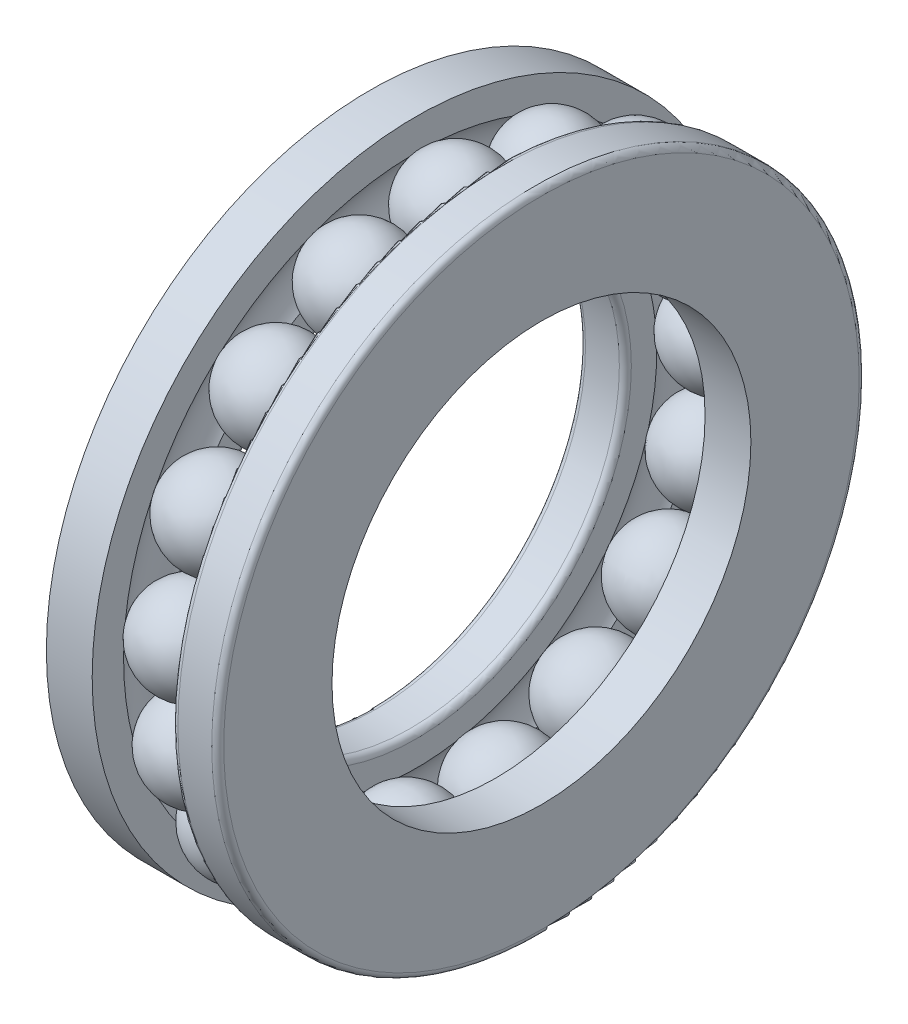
SolidWorks part; units mm, degrees
ref_plane "Plane1" through (0, 0, 0) normal (0, 0, 1) x (1, 0, 0)
ref_plane "Plane2" through (0, 0, 0) normal (0, 1, 0) x (1, 0, 0)
ref_plane "Plane3" through (0, 0, 0) normal (1, 0, 0) x (0, 0, -1)
other "Configuration Table"
sketch "Clipboard" plane through (0, 0, 0) normal (0, 0, 1) x (1, 0, 0)
  line L0 (-10, 0) -> (10, 0) construction
  line L1 (0, 0) -> (21.3836, -6.5376)
  line L2 (0, 0) -> (27.3662, 35.0271)
  line L3 (0, 0) -> (13.7666, -17.6205)
  line L4 (0, 0) -> (-22.3471, -0.7804)
sketch "InnRacSke" plane through (0, 0, 0) normal (0, 0, 1) x (1, 0, 0)
  line L0 (-6.6469, 40.1573) -> (-6.6469, 34.925)
  line L1 (-6.6469, 34.925) -> (-14.2875, 34.925)
  line L2 (-14.2875, 34.925) -> (-14.2875, 53.975)
  line L3 (-14.2875, 53.975) -> (-6.6469, 53.975)
  line L4 (-6.6469, 53.975) -> (-6.6469, 48.7427)
  line L5 (-34.925, 0) -> (34.925, 0) construction
  line L6 (0, 0) -> (0, 25.4) construction
  arc A2 (-6.6469, 48.7427) -> (-6.6469, 40.1573) centre (0, 44.45) ccw
revolve "Race" add sketch "InnRacSke" angle 360 about L5
ref_axis "Axis1" through (-50, 0, 0) along (1, 0, 0)
sketch "BalDetSke" plane through (0, 0, 0) normal (0, 0, 1) x (1, 0, 0)
  line L0 (-7.9375, 44.45) -> (7.9375, 44.45)
  line L1 (-14.5732, 44.45) -> (14.5732, 44.45) construction
  arc A0 (7.9375, 44.45) -> (-7.9375, 44.45) centre (0, 44.45) cw
revolve "BallDetailed" add sketch "BalDetSke" angle 360 about L1
sketch "BalSimSke" plane through (0, 0, 0) normal (0, 0, 1) x (1, 0, 0)
  line L0 (-25.4, 0) -> (25.4, 0) construction
  circle A0 centre (0, 44.45) radius 7.9375
revolve "BallsSimplified" [suppressed] add sketch "BalSimSke" angle 360 about L0
mirror "Mirror1" about plane through (0, 0, 0) normal (1, 0, 0) of "Race"
fillet "Fillet" radius 1 4 edges at (6.6469, 0, -53.975) (14.2875, 0, -53.975) (-6.6469, 0, -34.925) (-14.2875, 0, -34.925)
pattern_circular "BallsDetailed" count 17 every 21.176 about axis through (-50, 0, 0) along (1, 0, 0) of "BallDetailed"
sketch "CagSpiSke" plane through (0, 0, 0) normal (0, 0, 1) x (1, 0, 0)
  line L0 (1.9844, 35.7188) -> (1.9844, 53.1812)
  line L1 (1.9844, 53.1812) -> (-1.9844, 53.1812)
  line L2 (-1.9844, 53.1812) -> (-1.9844, 35.7188)
  line L3 (-1.9844, 35.7188) -> (1.9844, 35.7188)
  line L4 (-34.925, 0) -> (34.925, 0) construction
  line L5 (0, 0) -> (0, 50.8) construction
revolve "CageSpine" [suppressed] add sketch "CagSpiSke" angle 360 about L4
equation "\"BallCLRad@Clipboard\" =  ( \"OD@InnRacSke\" + \"ID@InnRacSke\" )  / 4"
equation "\"BallCLRad@BalSimSke\" = \"BallCLRad@Clipboard\""
equation "\"BallCLRad@BalDetSke\" = \"BallCLRad@Clipboard\""
equation "\"BallCLRad@InnRacSke\" = \"BallCLRad@Clipboard\""
equation "\"Ball_diameter@InnRacSke\" = \"Ball_diameter@BalDetSke\" - 0.05"
equation "\"Ball_diameter@BalSimSke\" = \"Ball_diameter@BalDetSke\""
equation "\"Max_count@Clipboard\" = int( 3.14159265 / atn(( \"Ball_diameter@BalDetSke\" / 2) / sqr( \"BallCLRad@Clipboard\"  *  \"BallCLRad@Clipboard\" - ( \"Ball_diameter@BalDetSke\" / 2) *  ( \"Ball_diameter@BalDetSke\" "
equation "\"Max_count@Clipboard\" = ((sgn( \"Max_count@Clipboard\" - \"Count@Clipboard\" )-1)*( \"Max_count@Clipboard\" - \"Count@Clipboard\" ))/-2+ \"Count@Clipboard\""
equation "\"Count@BallsDetailed\" = int( \"Show_count@Clipboard\" ) "
equation "\"Count@BallsDetailed\" = ((sgn( \"Count@BallsDetailed\" - \"Max_count@Clipboard\" )-1)*( \"Count@BallsDetailed\" - \"Max_count@Clipboard\" ))/-2+ \"Max_count@Clipboard\""
equation "\"Count@BallsDetailed\" = ((sgn( \"Count@BallsDetailed\" - \"Min_count@Clipboard\" )+1)*( \"Count@BallsDetailed\" - \"Min_count@Clipboard\"))/2 +\"Min_count@Clipboard\""
equation "\"Angle@BallsDetailed\" = 360.0 / \"Max_count@Clipboard\""
equation "\"Angle@CageSpine\" =  \"Angle@BallsDetailed\" * ( \"Count@BallsDetailed\" -1 + int( \"Count@BallsDetailed\" / \"Max_count@Clipboard\" ) )  + 0.001 -  int( \"Count@BallsDetailed\" / \"Max_count@Clipboard\" ) * 0.00"
equation "\"Angle@CageSpine\" =  \"Angle@CageSpine\" * int( \"Min_count@Clipboard\" / 2) + int(1 / \"Min_count@Clipboard\")  * 0.001"
equation "\"Thickness@CagSpiSke\" =  \"Ball_diameter@BalDetSke\" * 0.25"
equation "\"OD@CagSpiSke\" = ( \"OD@InnRacSke\" + ( \"BallCLRad@Clipboard\" * 2 + \"Ball_diameter@BalDetSke\" )) / 2"
equation "\"ID@CagSpiSke\" = ( \"ID@InnRacSke\" + ( \"BallCLRad@Clipboard\" * 2 - \"Ball_diameter@BalDetSke\" )) / 2"
